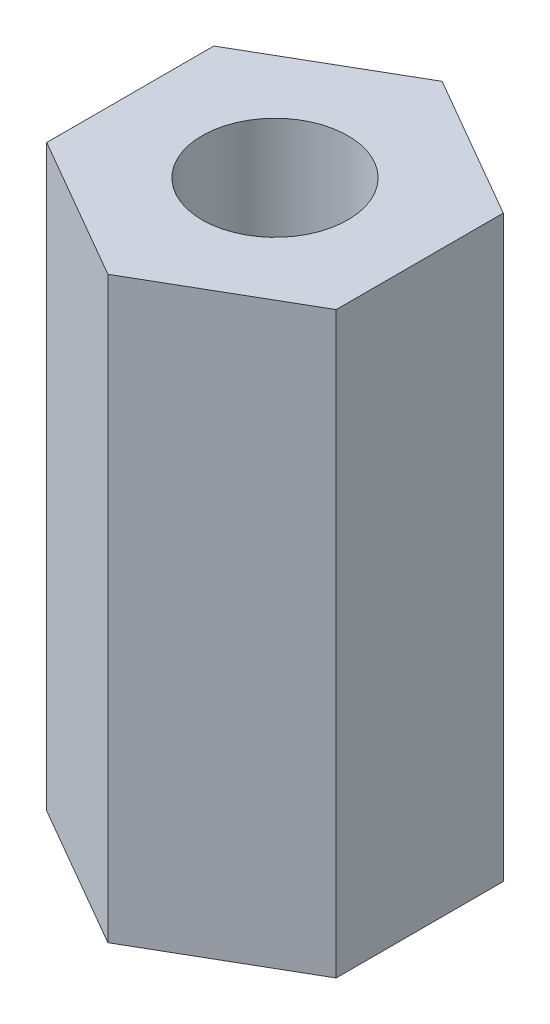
SolidWorks part; units mm, degrees
ref_plane "Front Plane" through (0, 0, 0) normal (0, 0, 1) x (1, 0, 0)
ref_plane "Top Plane" through (0, 0, 0) normal (0, 1, 0) x (1, 0, 0)
ref_plane "Right Plane" through (0, 0, 0) normal (1, 0, 0) x (0, 0, -1)
sketch "Sketch1" plane through (0, 0, 0) normal (0, 1, 0) x (1, 0, 0)
  line L1 (0, 7.3323) -> (-6.35, 3.6662)
  line L2 (-6.35, 3.6662) -> (-6.35, -3.6662)
  line L3 (-6.35, -3.6662) -> (0, -7.3323)
  line L4 (0, -7.3323) -> (6.35, -3.6662)
  line L5 (6.35, -3.6662) -> (6.35, 3.6662)
  line L6 (6.35, 3.6662) -> (0, 7.3323)
  circle A1 centre (0, 0) radius 3.2004
  circle A2 centre (0, 0) radius 6.35 construction
  dimension "D1" = 6.4008
  dimension "D2" = 12.7
extrude "Extrude1" add sketch "Sketch1" along normal blind 25.4
